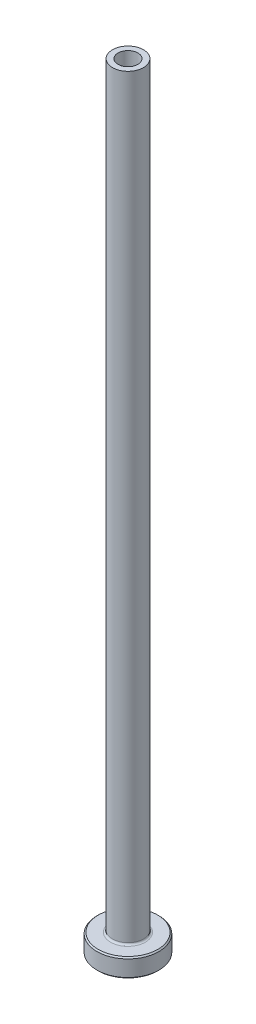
SolidWorks part; units mm, degrees
ref_plane "Front Plane" through (0, 0, 0) normal (0, 0, 1) x (1, 0, 0)
ref_plane "Top Plane" through (0, 0, 0) normal (0, 1, 0) x (1, 0, 0)
ref_plane "Right Plane" through (0, 0, 0) normal (1, 0, 0) x (0, 0, -1)
sketch "Sketch1" plane through (0, 0, 0) normal (0, 0, 1) x (1, 0, 0)
  line L0 (-1.6, 125) -> (-2.5, 125)
  line L1 (-2.5, 125) -> (-2.5, 3)
  line L2 (-2.5, 3) -> (-5, 3)
  line L3 (-5, 3) -> (-5, 0)
  line L4 (5.5, 0) -> (-5.5, 0) construction
  line L5 (-5, 0) -> (-1.85, 0)
  line L6 (-1.6, 80) -> (-1.6, 125)
  line L7 (0, 92.1877) -> (0, -15.5353) construction
  line L8 (0, -5.5) -> (0, 5.5) construction
  line L9 (-1.6, 80) -> (-1.85, 68)
  line L10 (-1.85, 68) -> (-1.85, 0)
  dimension "D1" = 0.25
  dimension "ID" = 3.2
  dimension "OD" = 5
  dimension "L" = 125
  dimension "H" = 10
  dimension "T" = 3
  dimension "N" = 45
  dimension "D2" = 12
revolve "Revolve1" add sketch "Sketch1" angle 360 about L7
fillet "Fillet1" radius 0.3 1 edges at (0, 3, 2.5)
chamfer "Chamfer1" distance 0.2 angle 45 2 edges at (0, 3, 5) (0, 0, 5)
chamfer "Chamfer3" distance 0.5 angle 45 1 edges at (0, 0, 1.85)
